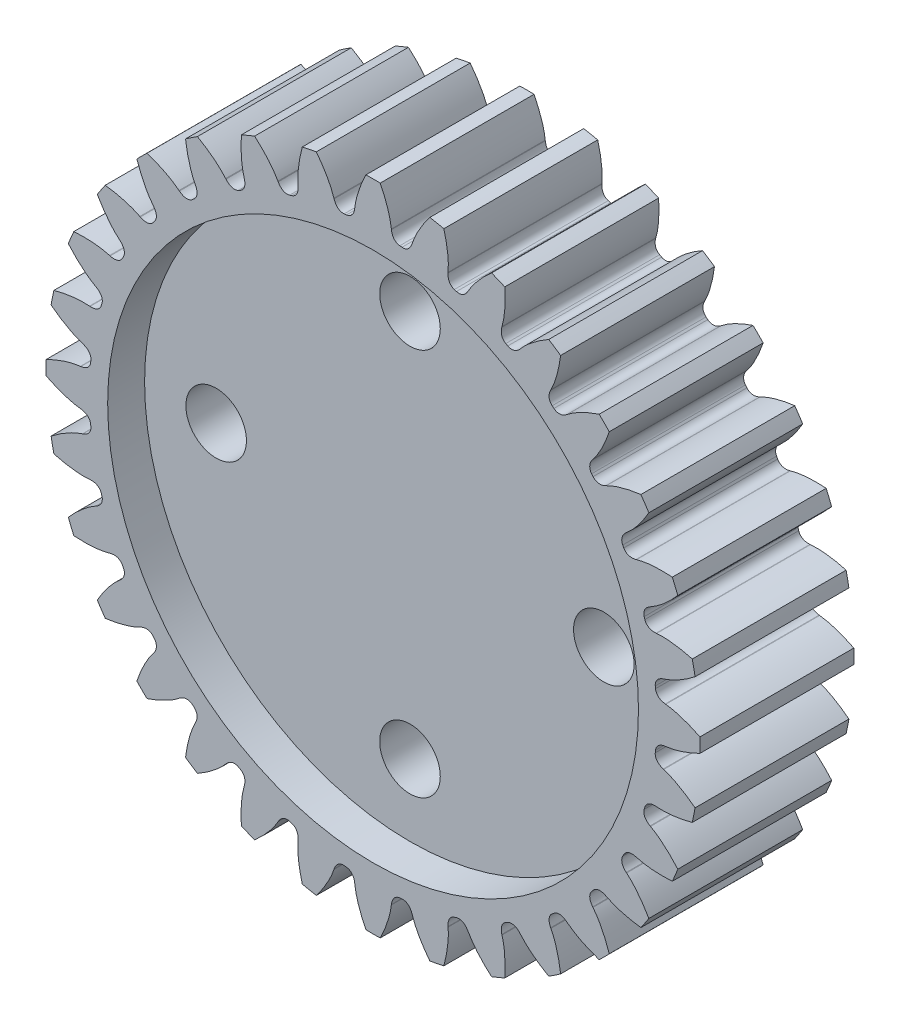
SolidWorks part; units mm, degrees
ref_plane "Front Plane" through (0, 0, 0) normal (0, 0, 1) x (1, 0, 0)
ref_plane "Top Plane" through (0, 0, 0) normal (0, 1, 0) x (1, 0, 0)
ref_plane "Right Plane" through (0, 0, 0) normal (1, 0, 0) x (0, 0, -1)
imported_body "Imported3"
hole_wizard "Hole1" positions "Sketch2" profile "Sketch1" legacy
sketch "Sketch2" plane through (0, 0, 0) normal (0, 0, -1) x (-1, 0, 0)
  point P0 (0, 0)
sketch "Sketch1" plane through (0, 0, 0) normal (1, 0, 0) x (0, 1, 0)
  line L0 (0, 0) -> (0, 1.905)
  line L1 (0, 1.905) -> (10.9538, 1.905)
  line L2 (10.9538, 1.905) -> (10.9538, 0)
  line L3 (10.9538, 0) -> (0, 0)
  line L4 (0, 110) -> (0, -10) construction
  dimension "Diameter" = 21.9075
  dimension "Depth" = 1.905
ref_plane "Plane1" through (0, 0, 3.556) normal (0, 0, 1) x (1, 0, 0)
sketch "Sketch6" plane through (0, 0, 6.35) normal (0, 0, 1) x (1, 0, 0)
  circle A0 centre (0, 0) radius 10.9537
extrude "Cut-Extrude3" cut sketch "Sketch6" against normal blind 1.524
sketch "Sketch7" plane through (0, 0, 4.826) normal (0, 0, 1) x (1, 0, 0)
  arc A0 (-7.9023, -1.2462) -> (-1.2462, -7.9023) centre (0, 0) ccw
  circle A1 centre (0, 8) radius 1.25
  circle A2 centre (8, 0) radius 1.25
  circle A3 centre (-8, 0) radius 1.25
  circle A4 centre (0, -8) radius 1.25
  arc A5 (-1.2462, 7.9023) -> (-7.9023, 1.2462) centre (0, 0) ccw
  arc A6 (7.9023, 1.2462) -> (1.2462, 7.9023) centre (0, 0) ccw
  arc A7 (1.2462, -7.9023) -> (7.9023, -1.2462) centre (0, 0) ccw
extrude "Cut-Extrude4" cut sketch "Sketch7" against normal through all contours A1 | A2 | A3 | A4
